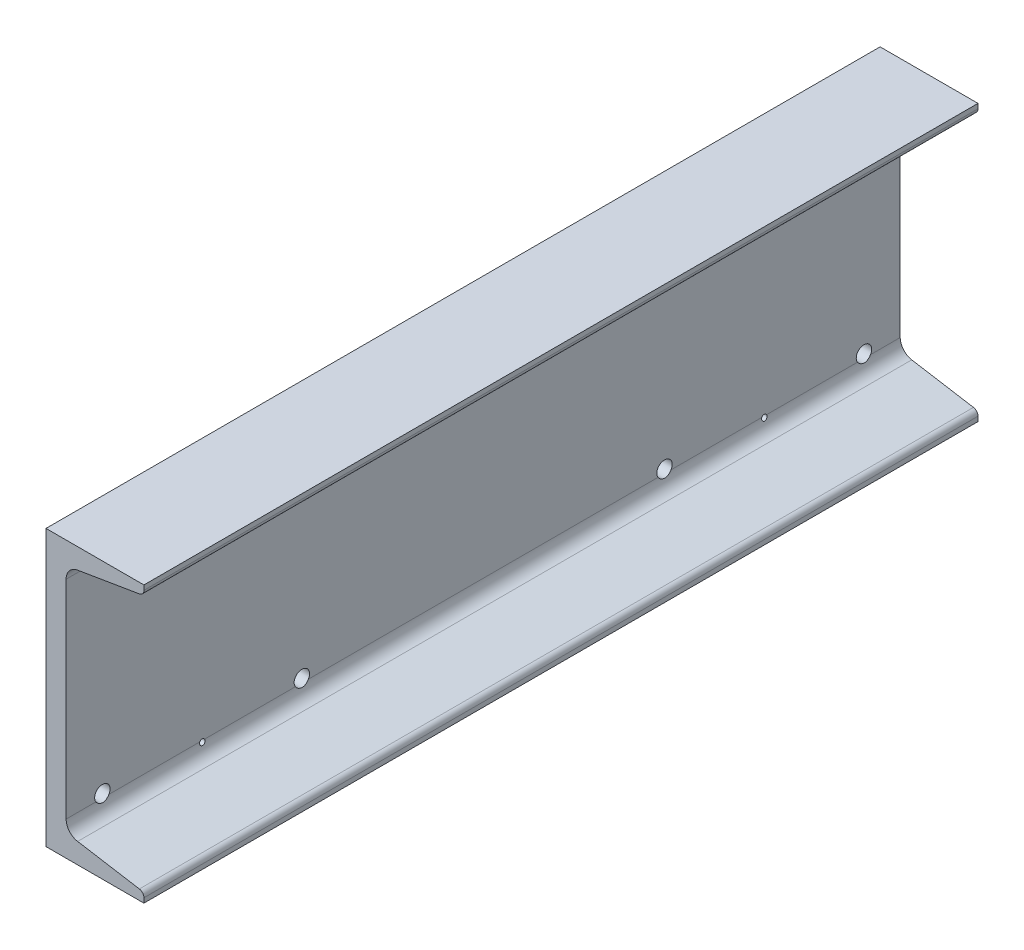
SolidWorks part; units mm, degrees
ref_plane "Plane1" through (0, 0, 0) normal (0, 0, 1) x (1, 0, 0)
ref_plane "Plane2" through (0, 0, 0) normal (0, 1, 0) x (-1, 0, 0)
ref_plane "Plane3" through (0, 0, 0) normal (1, 0, 0) x (0, 0, -1)
extrude "BaseMchannel" add sketch "Sketch1" along normal mid plane 460
sketch "Sketch1" plane through (0, 0, 0) normal (0, 0, 1) x (1, 0, 0)
  line L0 (54, 152) -> (0, 152)
  line L1 (54, 0) -> (0, 0)
  line L2 (0, 152) -> (0, 0)
  line L3 (7.8492, 0) -> (-7.8492, 0) construction
  line L4 (0, -15.6984) -> (0, 15.6984) construction
  line L5 (0, 8.7) -> (89.0016, 8.7) construction
  line L6 (54, 152) -> (54, 146.8753)
  line L7 (54, 0) -> (54, 5.1247)
  line L12 (11.1, 133.2867) -> (11.1, 18.7133)
  line L17 (17.4505, 140.7832) -> (54, 146.8753)
  line L18 (17.4505, 11.2168) -> (54, 5.1247)
  arc A9 (11.1, 18.7133) -> (17.4505, 11.2168) centre (18.7, 18.7133) ccw
  arc A10 (11.1, 133.2867) -> (17.4505, 140.7832) centre (18.7, 133.2867) cw
  dimension "RI" = 7.6
  dimension "D2" = 9.463
  dimension "D3" = 18.7133
  dimension "Depth" = 152
  dimension "BF" = 54
  dimension "TW" = 11.1
  dimension "TF" = 8.7
  dimension "d1" = 114.5733
fillet "ToeFillet" radius 3 2 edges at (54, 5.1247, 0) (54, 146.8753, 0)
hole_wizard "M10x1.5 Gewindekernloch1" positions "Skizze2" profile "Skizze1" tap size "M10x1.5" standard "DIN"
sketch "Skizze2" plane through (0, 0, 0) normal (-1, 0, 0) x (0, 0, 1)
  line L0 (-230, 76) -> (230, 76) construction
  line L1 (-230, 152) -> (-230, 0) construction
  line L2 (230, 152) -> (230, 0) construction
  point P0 (-210, 21)
  point P10 (-210, 131)
  point P12 (-100, 131)
  point P14 (-100, 21)
  dimension "D1" = 110
  dimension "D2" = 110
  dimension "D3" = 20
sketch "Skizze1" plane through (0, 21, -210) normal (0, 1, 0) x (0, 0, 1)
  line L0 (0, 0) -> (0, 54)
  line L1 (0, 54) -> (4.25, 54)
  line L2 (4.25, 54) -> (4.25, 0)
  line L5 (4.25, 0) -> (0, 0)
  line L11 (0, -6.35) -> (0, 107.95) construction
  dimension "Bohrerdurchmesser" = 8.5
  dimension "Bohrungstiefe" = 54
pattern_linear "Lineares Muster1" count 2 spacing 310 along (0, 0, 1) of "M10x1.5 Gewindekernloch1"
sketch "Skizze3" plane through (0, 0, 0) normal (-1, 0, 0) x (0, 0, 1)
  line L1 (230, 0) -> (-230, 0) construction
  line L2 (155, 0) -> (155, 150.6251) construction
  line L3 (227.5409, 76) -> (61.1724, 76) construction
  circle A0 centre (155, 18) radius 1.5
  circle A1 centre (155, 134) radius 1.5
  dimension "D1" = 3
  dimension "D2" = 58
extrude "Schnitt-Linear austragen1" cut sketch "Skizze3" against normal through all
mirror "Spiegeln1" about plane through (0, 0, 0) normal (0, 0, 1) of "Schnitt-Linear austragen1"
equation "\"d1@Sketch1\" = \"Depth@Sketch1\" - 2*\"TF@Sketch1\" -  2*( \"RI@Sketch1\" * cos(\"D2@Sketch1\"/180*3.141592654))-2*((((\"BF@Sketch1\"-\"TW@Sketch1\")/2)-(\"RI@Sketch1\"-\"RI@Sketch1\"*sin(\"D2@Sketch1\"/180*3.141592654"
equation "\"D3@Sketch1\" =  ( \"Depth@Sketch1\" - \"d1@Sketch1\" )  / 2"
